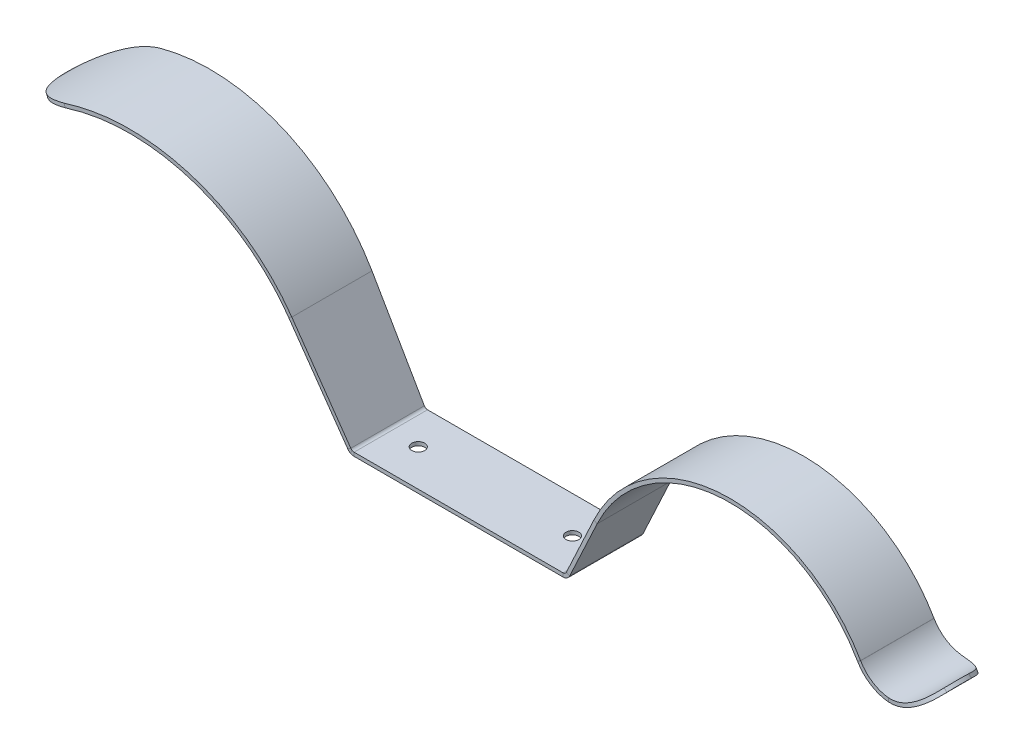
SolidWorks part; units mm, degrees
ref_plane "Front Plane" through (0, 0, 0) normal (0, 0, 1) x (1, 0, 0)
ref_plane "Top Plane" through (0, 0, 0) normal (0, 1, 0) x (1, 0, 0)
ref_plane "Right Plane" through (0, 0, 0) normal (1, 0, 0) x (0, 0, -1)
sketch "Sketch2" plane through (0, 0, 0) normal (0, 1, 0) x (1, 0, 0)
  line L0 (0, 0) -> (268, 0)
  line L1 (268, 0) -> (268, -20) construction
  line L2 (0, 0) -> (0, -26) construction
  line L3 (153, -20) -> (153, 0) construction
  line L4 (95, 0) -> (95, -20) construction
  line L5 (153, -20) -> (95, -20)
  line L6 (268, -20) -> (153, -20)
  line L7 (153, -10) -> (95, -10) construction
  line L8 (95, -20) -> (0, -26)
  arc A0 (268, -20) -> (268, 0) centre (268, -10) ccw
  arc A1 (0, 0) -> (0, -26) centre (0, -13) ccw
  circle A2 centre (103, -10) radius 1.75
  circle A3 centre (145, -10) radius 1.75
  dimension "D1" = 10
  dimension "D2" = 13
  dimension "D3" = 115
  dimension "D4" = 95
  dimension "D5" = 8
  dimension "D6" = 8
  dimension "D7" = 42
  dimension "D8" = 3.5
  dimension "D9" = 3.5
sheet metal parameters "Sheet-Metal1" thickness 1 parameters "D1"=1
base flange "Base-Flange1" sketch "Sketch2" thickness 1 reverse thickness direction yes parameters "D1"=1
sketch "Sketch4" plane through (0, 1, 0) normal (0, 1, 0) x (1, 0, 0)
  line L0 (95, -20) -> (95, 0)
  line L1 (268, 0) -> (0, 0) construction
sketched bend "Sketched Bend1" parameters "D1"=1
bend "SketchBend1" bend radius 1 bend angle 60 parameters "D5"=1
sketch "Sketch5" plane through (0, 1, 0) normal (0, 1, 0) x (1, 0, 0)
  line L0 (153, 0) -> (153, -20)
  line L1 (268, 0) -> (95.5236, 0) construction
  line L2 (95.5236, -20) -> (268, -20) construction
  circle A0 centre (145, -10) radius 1.75 construction
  dimension "D1" = 8
sketched bend "Sketched Bend2" parameters "D1"=1
bend "SketchBend2" bend radius 1 bend angle 65 parameters "D5"=2
sketch "Sketch6" plane through (125.3476, -58.4505, 0) normal (-0.9063, 0.4226, 0) x (0, 0, 1)
  line L0 (0, 180.6662) -> (20, 180.6662)
sketched bend "Sketched Bend4" parameters "D1"=10
bend "SketchBend3" bend radius 10 bend angle 108 parameters "D5"=3
sketch "Sketch7" plane through (0, 0, 20) normal (0, 0, 1) x (1, 0, 0)
  line L0 (95.5236, 1) -> (37.5236, 1) construction
  line L1 (47.4194, 83.319) -> (94.6576, 1.5) construction
  circle A0 centre (37.5236, 1) radius 49.7295
  point P6 (80.5906, 25.8647)
  dimension "D1" = 58
sketch "Sketch9" plane through (71.6427, 41.3629, 0) normal (0.866, 0.5, 0) x (0, 0, -1)
  line L0 (-20, -17.8958) -> (0, -17.8958) construction
  line L1 (0, -46.0298) -> (0, 48.4466) construction
  line L2 (-11.5, 21.7754) -> (0, 21.7754)
  line L3 (-13, 61.4466) -> (-10, -17.8958) construction
  arc A0 (0, 48.4466) -> (-26, 48.4466) centre (-13, 48.4466) ccw construction
sketched bend "Sketched Bend5" parameters "D1"=50
bend "SketchBend4" bend radius 50 bend angle 90 parameters "D5"=4
sketch "Sketch11" plane through (0, 0, 20) normal (0, 0, 1) x (1, 0, 0)
  line L0 (152.4328, 1) -> (196.4328, 1) construction
  line L1 (153.3391, 1.5774) -> (197.7174, 96.7469) construction
  circle A0 centre (196.4328, 1) radius 39.3002
  point P6 (160.8147, 17.609)
  dimension "D1" = 44
sketch "Sketch12" plane through (125.3476, -58.4505, 0) normal (-0.9063, 0.4226, 0) x (0, 0, 1)
  line L0 (20, 83.9224) -> (0, 83.9224) construction
  line L1 (0, 171.2415) -> (0, 66.2335) construction
  line L2 (10, 171.2415) -> (10, 83.9224) construction
  line L3 (20, 171.2415) -> (0, 171.2415) construction
  line L4 (10, 127.5819) -> (0, 127.5819)
sketched bend "Sketched Bend6" parameters "D1"=40
bend "SketchBend5" bend radius 40 bend angle 125 parameters "D5"=5
flat pattern "Flat-Pattern1"
sketch "Bend-Lines1" plane through (0, 0, 0) normal (0, 1, 0) x (-1, 0, 0)
bend of the flat pattern "Flatten-<SketchBend1>1"
bend of the flat pattern "Flatten-<SketchBend2>1"
bend of the flat pattern "Flatten-<SketchBend3>1"
bend of the flat pattern "Flatten-<SketchBend4>1"
bend of the flat pattern "Flatten-<SketchBend5>1"
